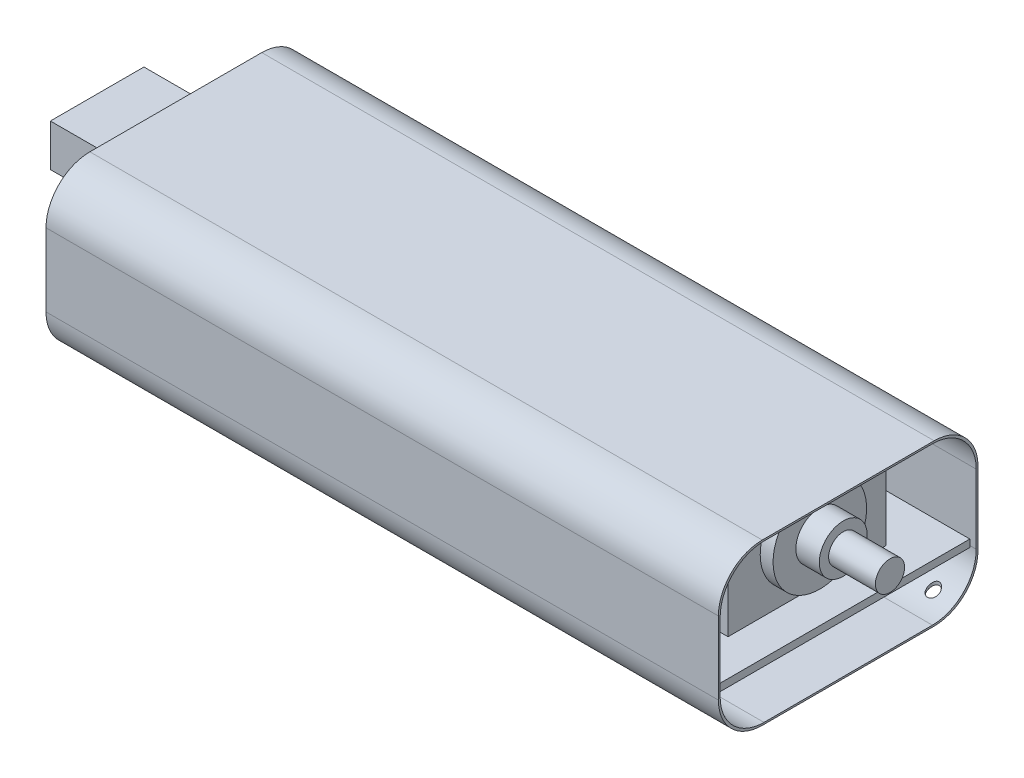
SolidWorks part; units mm, degrees
ref_plane "FRONT" through (0, 0, 0) normal (0, 0, 1) x (1, 0, 0)
ref_plane "TOP" through (0, 0, 0) normal (0, 1, 0) x (1, 0, 0)
ref_plane "RIGHT" through (0, 0, 0) normal (1, 0, 0) x (0, 0, -1)
sketch "Sketch1" plane through (0, 0, 0) normal (0, 1, 0) x (1, 0, 0)
  line L0 (0, 0) -> (145.034, 0)
  line L1 (0, 0) -> (0, 54.991)
  line L2 (145.034, 54.991) -> (0, 54.991)
  line L3 (145.034, 54.991) -> (145.034, 0)
  dimension "D1" = 145.034
  dimension "D2" = 54.991
extrude "Base-Extrude" add sketch "Sketch1" along normal blind 1.6002
sketch "Sketch2" plane through (0, 1.6002, 0) normal (0, 1, 0) x (-1, 0, 0)
  line L0 (0, 0) -> (-87.884, 0)
  line L1 (0, 0) -> (0, -54.991)
  line L2 (-87.884, -54.991) -> (0, -54.991)
  line L3 (-87.884, -54.991) -> (-87.884, 0)
  line L4 (-145.034, -54.991) -> (0, -54.991) construction
  dimension "D1" = 87.884
extrude "Boss-Extrude1" add sketch "Sketch2" along normal blind 12.7
sketch "Sketch16" plane through (0, 0, 0) normal (-1, 0, 0) x (0, 0, 1)
  line L0 (0, 0) -> (-54.991, 0) construction
  line L1 (-37.6555, 8.89) -> (-17.3355, 8.89)
  line L2 (-37.6555, 8.89) -> (-37.6555, 18.034)
  line L3 (-37.6555, 18.034) -> (-17.3355, 18.034)
  line L4 (-17.3355, 8.89) -> (-17.3355, 18.034)
  line L5 (-27.4955, 8.89) -> (-27.4955, 0) construction
  dimension "D1" = 8.89
  dimension "D2" = 9.144
  dimension "D3" = 20.32
extrude "Conn Comm" add sketch "Sketch16" along normal blind 17.018 and the other way blind 6.35
sketch "Sketch17" plane through (0, 1.6002, 0) normal (0, 1, 0) x (-1, 0, 0)
  line L0 (-87.884, -54.991) -> (0, -54.991) construction
  line L1 (-2.54, -52.451) -> (-7.62, -52.451)
  line L2 (-2.54, -52.451) -> (-2.54, -42.291)
  line L3 (-2.54, -42.291) -> (-7.62, -42.291)
  line L4 (-7.62, -52.451) -> (-7.62, -42.291)
  line L5 (-33.02, -7.62) -> (-40.64, -7.62)
  line L6 (-33.02, -7.62) -> (-33.02, -5.08)
  line L7 (-33.02, -5.08) -> (-40.64, -5.08)
  line L8 (-40.64, -7.62) -> (-40.64, -5.08)
  line L9 (0, -37.6555) -> (0, -54.991) construction
  line L10 (0, 0) -> (-87.884, 0) construction
  line L11 (0, 0) -> (0, -17.3355) construction
  dimension "D1" = 10.16
  dimension "D2" = 5.08
  dimension "D3" = 2.54
  dimension "D4" = 2.54
  dimension "D5" = 5.08
  dimension "D6" = 7.62
  dimension "D7" = 2.54
  dimension "D8" = 33.02
extrude "Conn Pins" add sketch "Sketch17" along direction (0, -1, 0) on the side of the normal blind 16.51 separate body
sketch "Sketch14" plane through (0, 0, 0) normal (0, -1, 0) x (1, 0, 0)
  line L1 (57.7366, -8.0534) -> (77.7894, -8.0534)
  line L2 (57.7366, -8.0534) -> (57.7366, -20.7534)
  line L3 (57.7366, -20.7534) -> (77.7894, -20.7534)
  line L4 (77.7894, -8.0534) -> (77.7894, -20.7534)
  line L5 (57.7366, -32.1084) -> (77.7894, -32.1084)
  line L6 (57.7366, -32.1084) -> (57.7366, -44.8084)
  line L7 (57.7366, -44.8084) -> (77.7894, -44.8084)
  line L8 (77.7894, -32.1084) -> (77.7894, -44.8084)
  dimension "D1" = 12.7
extrude "Coils" add sketch "Sketch14" along normal blind 9.525
sketch "Sketch3" plane through (0, 1.6002, 0) normal (0, 1, 0) x (-1, 0, 0)
  line L0 (-117.0305, -27.4955) -> (-145.796, -27.4955) construction
  line L1 (-145.034, -27.4955) -> (-124.714, -27.4955) construction
  line L2 (-145.034, -54.991) -> (-145.034, 0) construction
  line L3 (-137.16, -10.3505) -> (-137.16, -44.6405)
  line L4 (-137.16, -44.6405) -> (-124.714, -44.6405)
  line L5 (-137.16, -10.3505) -> (-124.714, -10.3505)
  line L6 (-124.714, -44.6405) -> (-124.714, -10.3505)
  point P7 (-137.16, -27.4955)
  point P10 (-124.714, -27.4955)
  dimension "D1" = 12.446
  dimension "D2" = 34.29
  dimension "D3" = 20.32
  dimension "D4" = 90
extrude "Boss-Extrude2" add sketch "Sketch3" along normal blind 22.606
ref_plane "Plane4" through (0, 13.5382, 0) normal (0, 1, 0) x (-1, 0, 0)
sketch "Sketch4" plane through (0, 13.5382, 0) normal (0, 1, 0) x (-1, 0, 0)
  line L0 (-137.16, -27.4955) -> (-155.194, -27.4955) construction
  line L1 (-137.16, -10.3505) -> (-137.16, -44.6405) construction
  line L2 (-155.194, -27.4955) -> (-155.194, -30.6705)
  line L3 (-155.194, -30.6705) -> (-145.034, -30.6705)
  line L4 (-145.034, -30.6705) -> (-145.034, -32.7025)
  line L5 (-145.034, -32.7025) -> (-139.954, -32.7025)
  line L6 (-139.954, -32.7025) -> (-139.954, -37.6555)
  line L7 (-139.954, -37.6555) -> (-137.16, -37.6555)
  line L8 (-137.16, -37.6555) -> (-137.16, -27.4955)
  line L9 (-137.16, -27.4955) -> (-155.194, -27.4955)
  point P17 (-155.194, -27.4955)
  dimension "D1" = 3.175
  dimension "D2" = 5.207
  dimension "D3" = 10.16
  dimension "D4" = 10.16
  dimension "D5" = 5.08
  dimension "D6" = 2.794
revolve "Boss-Revolve1" add sketch "Sketch4" angle 360 about L0
sketch "Sketch5" plane through (0, 13.5382, 0) normal (0, 1, 0) x (-1, 0, 0)
  line L0 (-124.714, -27.4955) -> (-108.889, -27.4955) construction
  line L1 (-124.714, -44.6405) -> (-124.714, -10.3505) construction
  line L2 (-124.714, -27.4955) -> (-124.714, -36.3855)
  line L3 (-124.714, -36.3855) -> (-122.936, -36.3855)
  line L4 (-122.936, -36.3855) -> (-122.936, -38.6715)
  line L5 (-122.936, -38.6715) -> (-105.918, -38.6715)
  line L6 (-105.918, -38.6715) -> (-105.918, -31.9405)
  line L7 (-105.918, -31.9405) -> (-96.393, -31.9405)
  line L8 (-96.393, -31.9405) -> (-96.393, -27.4955)
  line L9 (-96.393, -27.4955) -> (-124.714, -27.4955)
  line L10 (-124.714, -44.6405) -> (-124.714, -10.3505) construction
  dimension "D1" = 8.89
  dimension "D2" = 11.176
  dimension "D3" = 4.445
  dimension "D4" = 1.778
  dimension "D5" = 17.018
  dimension "D6" = 9.525
revolve "Boss-Revolve2" add sketch "Sketch5" angle 360 about L0
ref_plane "Plane5" through (0, 0, -27.4955) normal (0, 0, -1) x (-1, 0, 0)
sketch "Sketch6" plane through (0, 0, 0) normal (0, -1, 0) x (1, 0, 0)
  line L0 (0, 0) -> (145.034, 0) construction
  line L1 (139.2639, -7.1755) -> (142.9301, -7.1755)
  line L2 (142.9301, -7.1755) -> (144.7632, -4.0005)
  line L3 (144.7632, -4.0005) -> (142.9301, -0.8255)
  line L4 (142.9301, -0.8255) -> (139.2639, -0.8255)
  line L5 (139.2639, -0.8255) -> (137.4308, -4.0005)
  line L6 (137.4308, -4.0005) -> (139.2639, -7.1755)
  line L7 (137.4308, -50.9905) -> (139.2639, -54.1655)
  line L8 (139.2639, -54.1655) -> (142.9301, -54.1655)
  line L9 (142.9301, -54.1655) -> (144.7632, -50.9905)
  line L10 (144.7632, -50.9905) -> (142.9301, -47.8155)
  line L11 (142.9301, -47.8155) -> (139.2639, -47.8155)
  line L12 (139.2639, -47.8155) -> (137.4308, -50.9905)
  line L13 (145.034, -54.991) -> (145.034, 0) construction
  line L15 (2.1039, -7.1755) -> (5.7701, -7.1755)
  line L16 (5.7701, -7.1755) -> (7.6032, -4.0005)
  line L17 (7.6032, -4.0005) -> (5.7701, -0.8255)
  line L18 (5.7701, -0.8255) -> (2.1039, -0.8255)
  line L19 (2.1039, -0.8255) -> (0.2708, -4.0005)
  line L20 (0.2708, -4.0005) -> (2.1039, -7.1755)
  line L21 (0.2708, -50.9905) -> (2.1039, -54.1655)
  line L22 (2.1039, -54.1655) -> (5.7701, -54.1655)
  line L23 (5.7701, -54.1655) -> (7.6032, -50.9905)
  line L24 (7.6032, -50.9905) -> (5.7701, -47.8155)
  line L25 (5.7701, -47.8155) -> (2.1039, -47.8155)
  line L26 (2.1039, -47.8155) -> (0.2708, -50.9905)
  line L27 (3.937, -4.0005) -> (141.097, -50.9905) construction
  line L28 (3.937, -4.0005) -> (141.097, -4.0005) construction
  line L29 (3.937, -4.0005) -> (3.937, -50.9905) construction
  line L30 (3.937, -50.9905) -> (141.097, -50.9905) construction
  line L31 (141.097, -4.0005) -> (141.097, -50.9905) construction
  line L32 (0, -54.991) -> (145.034, 0) construction
  circle A0 centre (141.097, -4.0005) radius 3.175 construction
  circle A1 centre (141.097, -50.9905) radius 3.175 construction
  circle A2 centre (3.937, -4.0005) radius 3.175 construction
  circle A3 centre (3.937, -50.9905) radius 3.175 construction
  circle A4 centre (3.937, -4.0005) radius 1.27
  circle A5 centre (141.097, -4.0005) radius 1.27
  circle A6 centre (141.097, -50.9905) radius 1.27
  circle A7 centre (3.937, -50.9905) radius 1.27
  point P38 (72.517, -27.4955)
  dimension "D1" = 6.35
  dimension "D2" = 6.35
  dimension "D4" = 46.99
  dimension "D6" = 6.35
  dimension "D7" = 6.35
  dimension "D3" = 2.54
  dimension "D8" = 137.16
  dimension "D9" = 46.99
extrude "HexStndOff" [suppressed] add sketch "Sketch6" along normal blind 15.875
sketch "Sketch7" plane through (0, 0, 0) normal (1, 0, 0) x (0, 0, -1)
  line L0 (9.271, 24.5872) -> (45.847, 24.5872)
  line L1 (8.89, 24.9682) -> (46.228, 24.9682)
  line L2 (-0.635, 15.4432) -> (-0.635, -0.381)
  line L3 (8.89, -9.906) -> (46.228, -9.906)
  line L4 (55.753, 15.4432) -> (55.753, -0.381)
  line L5 (55.372, 15.0622) -> (55.372, 0)
  line L6 (9.271, -9.525) -> (45.847, -9.525)
  line L7 (-0.254, 15.0622) -> (-0.254, 0)
  line L8 (44.6405, 24.2062) -> (10.3505, 24.2062) construction
  line L9 (54.991, 0) -> (0, 0) construction
  line L10 (54.991, 14.3002) -> (54.991, 0) construction
  arc A1 (45.847, 24.5872) -> (55.372, 15.0622) centre (45.847, 15.0622) cw
  arc A2 (46.228, 24.9682) -> (55.753, 15.4432) centre (46.228, 15.4432) cw
  arc A3 (9.271, 24.5872) -> (-0.254, 15.0622) centre (9.271, 15.0622) ccw
  arc A4 (8.89, 24.9682) -> (-0.635, 15.4432) centre (8.89, 15.4432) ccw
  arc A5 (55.372, 0) -> (45.847, -9.525) centre (45.847, 0) cw
  arc A6 (46.228, -9.906) -> (55.753, -0.381) centre (46.228, -0.381) ccw
  arc A7 (9.271, -9.525) -> (-0.254, 0) centre (9.271, 0) cw
  arc A8 (-0.635, -0.381) -> (8.89, -9.906) centre (8.89, -0.381) ccw
  point P14 (55.753, 24.9682)
  point P19 (-0.635, 24.9682)
  point P28 (-0.635, -9.906)
  dimension "D3" = 0.762
  dimension "D4" = 0.762
  dimension "D6" = 9.525
  dimension "D1" = 56.388
  dimension "D2" = 9.525
  dimension "D5" = 0.381
extrude "Shield" add sketch "Sketch7" along normal blind 146.05
sketch "Fiber ends" plane through (155.194, 0, 0) normal (1, 0, 0) x (0, 0, -1)
  circle A0 centre (25.9715, 13.5382) radius 1.397
  circle A1 centre (29.0195, 13.5382) radius 1.397
  circle A2 centre (27.4955, 13.5382) radius 3.175 construction
  point P0 (27.4955, 13.5382)
  dimension "D1" = 2.794
  dimension "D2" = 1.524
  dimension "D3" = 1.524
sketch "Fiber paths" plane through (0, 13.5382, 0) normal (0, 1, 0) x (-1, 0, 0)
  line L0 (-155.194, -29.0195) -> (-167.894, -29.0195)
  line L1 (-155.194, -25.9715) -> (-167.894, -25.9715)
  line L2 (-155.194, -29.0195) -> (-155.194, -25.9715) construction
  dimension "D1" = 12.7
sketch "Sketch18" plane through (0, -9.906, 0) normal (0, -1, 0) x (1, 0, 0)
  circle A1 centre (3.937, -50.9905) radius 1.27
  circle A2 centre (3.937, -50.9905) radius 1.27
  circle A3 centre (141.097, -50.9905) radius 1.27
  circle A4 centre (141.097, -50.9905) radius 1.27
  circle A5 centre (141.097, -4.0005) radius 1.27
  circle A6 centre (141.097, -4.0005) radius 1.27
  circle A7 centre (3.937, -4.0005) radius 1.27
  circle A8 centre (3.937, -4.0005) radius 1.27
  dimension "D4" = 0
  dimension "D5" = 0
  dimension "D6" = 0
  dimension "D7" = 0
extrude "Cut-Extrude1" cut sketch "Sketch18" against normal blind 6.35
ref_plane "Plane6" through (0, 0, -27.559) normal (0, 0, 1) x (1, 0, 0)
ref_plane "Plane7" through (72.517, 0, 0) normal (1, 0, 0) x (0, 0, -1)
